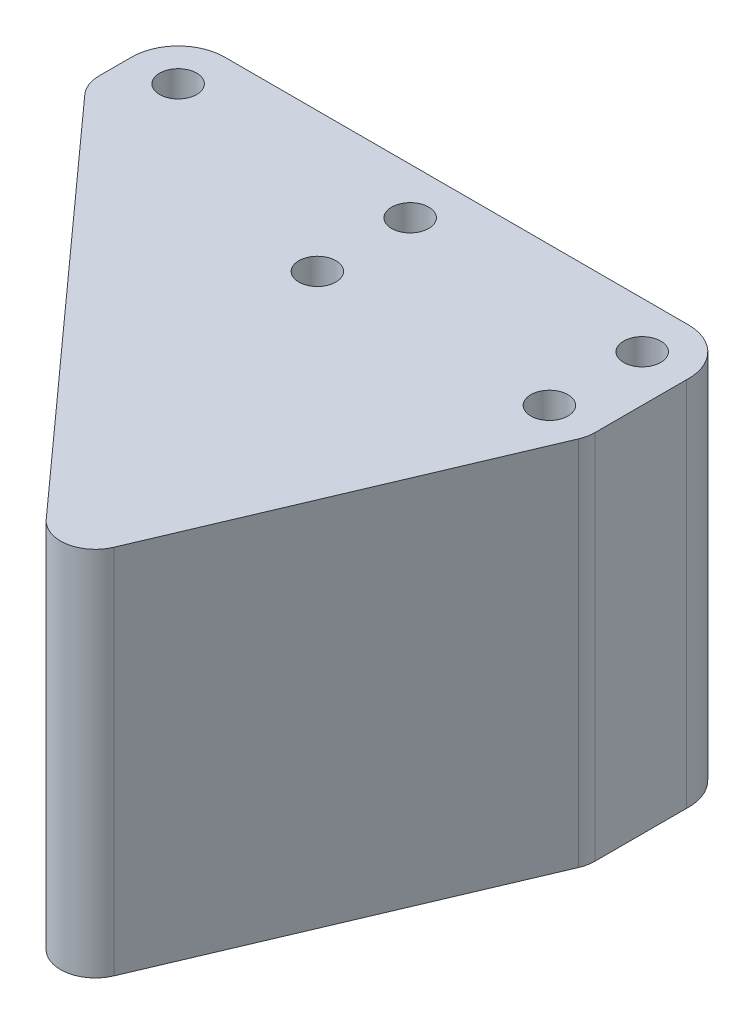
SolidWorks part; units mm, degrees
ref_plane "前视基准面" through (0, 0, 0) normal (0, 0, 1) x (1, 0, 0)
ref_plane "上视基准面" through (0, 0, 0) normal (0, 1, 0) x (1, 0, 0)
ref_plane "右视基准面" through (0, 0, 0) normal (1, 0, 0) x (0, 0, -1)
other "Configuration Table"
sketch "草图1" plane through (0, 0, 0) normal (0, 1, 0) x (1, 0, 0)
  line L0 (0, -8) -> (-180, -8)
  line L1 (-180.9424, -2.1518) -> (-160, 4.7773)
  line L2 (-140, 8) -> (0, 8)
  line L3 (-180, -5) -> (-170, -5) construction
  arc A0 (0, 8) -> (0, -8) centre (0, 0) cw
  arc A1 (-180, -8) -> (-180.9424, -2.1518) centre (-180, -5) cw
  circle A2 centre (0, 0) radius 4
  circle A3 centre (-70, 0) radius 4
  circle A4 centre (-180, -5) radius 1.6
  circle A5 centre (-170, -5) radius 1.6
  circle A6 centre (-160, -5) radius 1.6
  arc A7 (-160, 4.7773) -> (-140, 8) centre (-140, -55.6703) cw
  dimension "D1" = 8
  dimension "D6" = 3.2
  dimension "D8" = 180
  dimension "D2" = 16
  dimension "D3" = 70
  dimension "D5" = 10
  dimension "D7" = 3
  dimension "D9" = 70
  dimension "D10" = 20
  dimension "D4" = 3
extrude "凸台-拉伸1" add sketch "草图1" along normal blind 4
sketch "草图2" plane through (0, 4, 0) normal (0, 1, 0) x (1, 0, 0)
  line L0 (-135, 5) -> (-115, 5) construction
  line L1 (0, 8) -> (-140, 8) construction
  line L2 (-180, -8) -> (0, -8) construction
  circle A0 centre (-135, 5) radius 1.6
  circle A1 centre (-115, 5) radius 1.6
  circle A2 centre (-95, 5) radius 1.6
  circle A3 centre (-160, -5) radius 1.6 construction
  circle A4 centre (-135, -4) radius 1.6
  circle A5 centre (-115, -4) radius 1.6
  circle A6 centre (-95, -4) radius 1.6
  circle A7 centre (-55, -4) radius 1.6
  circle A8 centre (-35, -4) radius 1.6
  circle A9 centre (-15, -4) radius 1.6
  circle A10 centre (-70, 0) radius 4 construction
  circle A11 centre (-55, 4) radius 1.6
  circle A12 centre (-35, 4) radius 1.6
  circle A13 centre (-15, 4) radius 1.6
  dimension "D3" = 3.2
  dimension "D8" = 35
  dimension "D1" = 20
  dimension "D4" = 25
  dimension "D5" = 3
  dimension "D7" = 4
  dimension "D10" = 2
  dimension "D11" = 4
  dimension "D2" = 3
  dimension "D6" = 2
  dimension "D9" = 2
extrude "切除-拉伸1" cut sketch "草图2" against normal through all
sketch "草图3" plane through (0, 4, 0) normal (0, 1, 0) x (1, 0, 0)
  line L0 (-64.0548, 5.353) -> (-7.8774, -57.0383) construction
  line L1 (-7.8774, -57.0383) -> (-19.7678, -67.7444) construction
  line L2 (-19.7678, -67.7444) -> (-75.9452, -5.353) construction
  line L3 (0, 8) -> (-140, 8) construction
  line L4 (-55, 8) -> (-15, 8)
  line L5 (-11.0035, 3.8321) -> (-11.0035, -4.6805)
  line L6 (-11.0035, -4.6805) -> (-25.0198, -37.7008)
  line L7 (-25.0198, -37.7008) -> (-59, 0.038)
  line L8 (-59, 0.038) -> (-59, 4)
  line L9 (7.364, -3.1258) -> (-19.2926, -65.925) construction
  line L10 (-19.2926, -65.925) -> (-34.0207, -59.6733) construction
  line L11 (-34.0207, -59.6733) -> (-7.364, 3.1258) construction
  arc A0 (-75.9452, -5.353) -> (-64.0548, 5.353) centre (-70, 0) cw construction
  arc A1 (-59, 4) -> (-55, 8) centre (-55, 4) cw
  arc A2 (-15, 8) -> (-11.0035, 3.8321) centre (-15, 4) cw
  circle A3 centre (-15, -4) radius 1.6 construction
  circle A4 centre (-55, 4) radius 1.6
  circle A5 centre (-35, 4) radius 1.6
  circle A6 centre (-35, -4) radius 1.6
  circle A7 centre (-15, 4) radius 1.6
  circle A8 centre (-15, -4) radius 1.6
  arc A9 (-7.364, 3.1258) -> (7.364, -3.1258) centre (0, 0) cw construction
  dimension "D1" = 8
  dimension "D4" = 3.9965
  dimension "D7" = 3.2
  dimension "D2" = 48
  dimension "D3" = 0.2
  dimension "D5" = 0.3
  dimension "D6" = 4
  dimension "D8" = 16
  dimension "D9" = 67
extrude "凸台-拉伸2" add sketch "草图3" along normal blind 32
sketch "草图4" plane through (0, 0, 0) normal (0, -1, 0) x (1, 0, 0)
  line L1 (-195, -15) -> (55, -15)
  line L2 (-195, -15) -> (-195, 15)
  line L3 (-195, 15) -> (55, 15)
  line L4 (55, -15) -> (55, 15)
  line L5 (-195, -15) -> (55, 15) construction
  line L6 (-195, 15) -> (55, -15) construction
  point P0 (-70, 0)
  dimension "D1" = 250
  dimension "D2" = 30
extrude "切除-拉伸2" cut sketch "草图4" against normal blind 4
fillet "圆角1" radius 3 3 edges at (-25.0198, 20, 37.7008) (-59, 20, -0.038) (-11.0035, 20, 4.6805)
